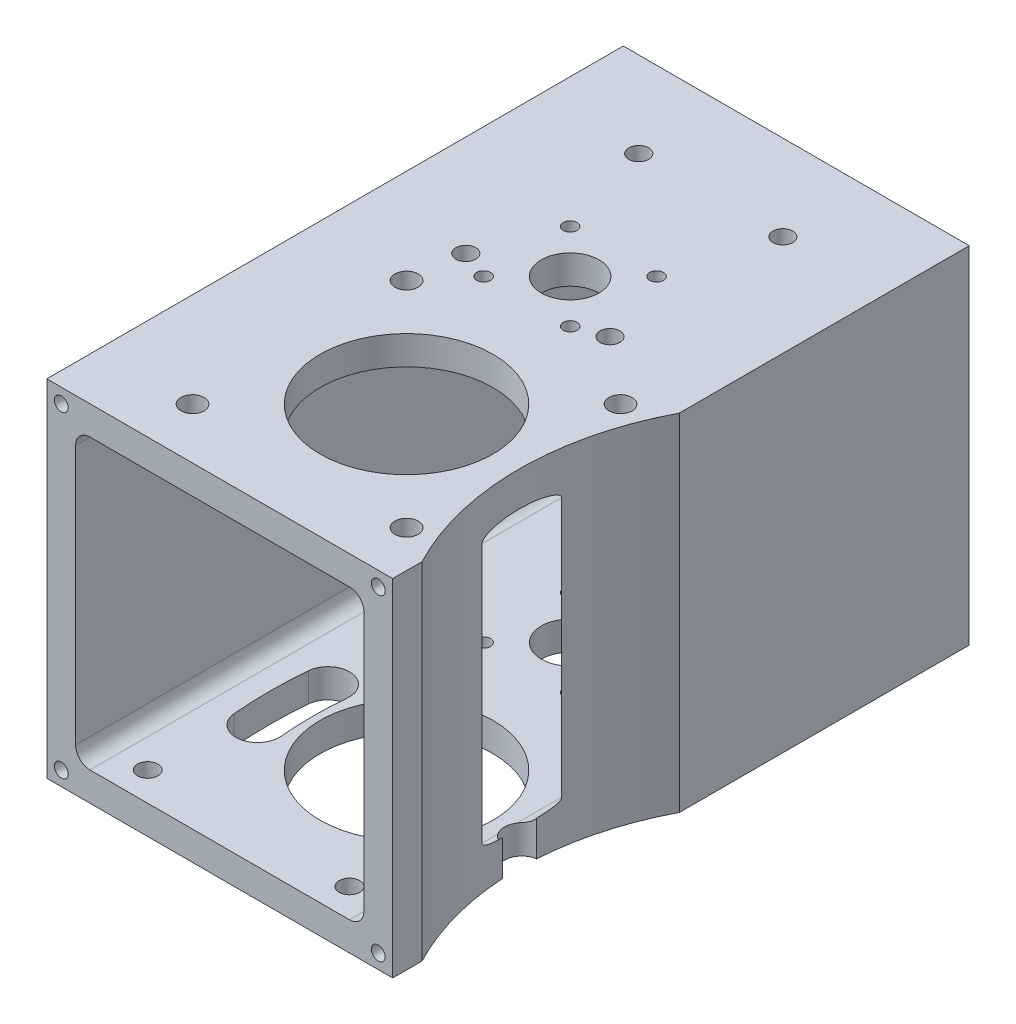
SolidWorks part; units mm, degrees
ref_plane "Front Plane" through (0, 0, 0) normal (0, 0, 1) x (1, 0, 0)
ref_plane "Top Plane" through (0, 0, 0) normal (0, 1, 0) x (1, 0, 0)
ref_plane "Right Plane" through (0, 0, 0) normal (1, 0, 0) x (0, 0, -1)
sketch "Sketch1" plane through (0, 0, 0) normal (0, 0, 1) x (1, 0, 0)
  line L1 (0, 0) -> (76.2, 0)
  line L2 (0, 0) -> (0, 76.2)
  line L3 (0, 76.2) -> (76.2, 76.2)
  line L4 (76.2, 0) -> (76.2, 76.2)
  line L5 (9.525, 69.85) -> (66.675, 69.85)
  line L6 (6.35, 66.675) -> (6.35, 9.525)
  line L7 (9.525, 6.35) -> (66.675, 6.35)
  line L8 (69.85, 66.675) -> (69.85, 9.525)
  arc A0 (9.525, 69.85) -> (6.35, 66.675) centre (9.525, 66.675) ccw
  arc A1 (66.675, 69.85) -> (69.85, 66.675) centre (66.675, 66.675) cw
  arc A2 (66.675, 6.35) -> (69.85, 9.525) centre (66.675, 9.525) ccw
  arc A3 (6.35, 9.525) -> (9.525, 6.35) centre (9.525, 9.525) ccw
  dimension "D7" = 3.175
  dimension "D1" = 76.2
  dimension "D2" = 76.2
  dimension "D3" = 6.35
  dimension "D4" = 6.35
  dimension "D5" = 6.35
  dimension "D6" = 6.35
extrude "Extrude1" add sketch "Sketch1" against normal blind 127
ref_plane "Plane1" through (44.45, 0, 0) normal (1, 0, 0) x (0, 0, -1)
sketch "Sketch2" plane through (0, 0, 0) normal (0, -1, 0) x (1, 0, 0)
  circle A0 centre (44.45, -34.798) radius 19.05
  circle A1 centre (44.45, -34.798) radius 7.1438 construction
  dimension "D1" = 38.1
extrude "Cut-Extrude1" cut sketch "Sketch2" against normal up to surface (76.2 mm away)
sketch "Sketch3" plane through (0, 76.2, 0) normal (0, 1, 0) x (-1, 0, 0)
  circle A0 centre (-38.1, -77.1875) radius 6.35
  circle A1 centre (-38.1, -77.1875) radius 6.35 construction
  dimension "D1" = 12.7
extrude "Cut-Extrude2" cut sketch "Sketch3" against normal up to surface (76.2 mm away)
sketch "Sketch6" plane through (0, 76.2, 0) normal (0, 1, 0) x (-1, 0, 0)
  circle A0 centre (-130.175, -34.798) radius 60.96
  arc A1 (-149.225, -95.3731) -> (-149.225, 25.7771) centre (-130.175, -34.798) ccw construction
  dimension "D1" = 121.92
extrude "Cut-Extrude5" cut sketch "Sketch6" against normal up to surface (76.2 mm away)
sketch "Sketch7" plane through (0, 0, 0) normal (0, -1, 0) x (1, 0, 0)
  circle A0 centre (69.85, -34.798) radius 3.81
  circle A1 centre (69.85, -34.798) radius 1.524 construction
  dimension "D1" = 7.62
extrude "Cut-Extrude8" cut sketch "Sketch7" against normal blind 25.4
hole_wizard "Tap Drill for #10 Helicoil1" positions "3DSketch1" profile "Sketch8" hole size "#10-32" standard "Ansi Inch"
sketch3d "3DSketch1"
  circle A0 centre (20.8788, 76.2, -11.2268) radius 2.5527 construction
  circle A1 centre (20.8788, 76.2, -58.3692) radius 2.5527 construction
  circle A2 centre (68.0212, 76.2, -58.3692) radius 2.5527 construction
  circle A3 centre (68.0212, 76.2, -11.2268) radius 2.5527 construction
  point P0 (68.0212, 76.2, -11.2268)
  point P2 (68.0212, 76.2, -58.3692)
  point P4 (20.8788, 76.2, -11.2268)
  point P6 (20.8788, 76.2, -58.3692)
  point P11 (20.8788, 78.7527, -11.2268)
  point P14 (20.8788, 78.7527, -58.3692)
  point P17 (68.0212, 78.7527, -58.3692)
  point P20 (68.0212, 78.7527, -11.2268)
sketch "Sketch8" plane through (68.0212, 76.2, -11.2268) normal (1, 0, 0) x (0, 0, 1)
  line L0 (0, 0) -> (0, 10.6778)
  line L1 (0, 10.6778) -> (2.5527, 9.144)
  line L2 (2.5527, 9.144) -> (2.5527, 0)
  line L5 (2.5527, 0) -> (0, 0)
  line L10 (0, 10.6778) -> (-2.5527, 9.144) construction
  line L11 (0, -6.35) -> (0, 107.95) construction
  dimension "Hole Dia." = 5.1054
  dimension "Hole Depth" = 9.144
  dimension "Drill Angle" = 118
hole_wizard "#8 Clearance Hole1" positions "3DSketch2" profile "Sketch10" hole size "#8" standard "Ansi Inch"
sketch3d "3DSketch2"
  line L1 (15.875, 0, -6.35) -> (15.875, 0, -120.65) construction
  line L5 (0, 0, -127) -> (0, 0, 0) construction
  line L9 (15.875, 0, -6.35) -> (60.325, 0, -6.35) construction
  line L13 (0, 0, 0) -> (76.2, 0, 0) construction
  line L16 (60.325, 0, -6.35) -> (60.325, 0, -120.65) construction
  line L18 (15.875, 0, -120.65) -> (60.325, 0, -120.65) construction
  line L20 (76.2, 0, -127) -> (76.2, 0, -63.1321) construction
  line L21 (0, 0, -127) -> (76.2, 0, -127) construction
  point P148 (15.875, 0, -120.65)
  point P150 (15.875, 0, -6.35)
  point P203 (60.325, 0, -6.35)
  point P205 (47.625, 0, -120.65)
  dimension "D1" = 15.875
  dimension "D2" = 6.35
  dimension "D3" = 15.875
  dimension "D5" = 6.35
  dimension "D4" = 28.575
sketch "Sketch10" plane through (15.875, 0, -120.65) normal (1, 0, 0) x (0, 0, -1)
  line L0 (0, 0) -> (0, 10.4947)
  line L1 (0, 10.4947) -> (2.2479, 9.144)
  line L2 (2.2479, 9.144) -> (2.2479, 0)
  line L5 (2.2479, 0) -> (0, 0)
  line L10 (0, 10.4947) -> (-2.2479, 9.144) construction
  line L11 (0, -6.35) -> (0, 107.95) construction
  dimension "Hole Dia." = 4.4958
  dimension "Hole Depth" = 9.144
  dimension "Drill Angle" = 118
hole_wizard "Tap Drill for #4 Helicoil1" positions "3DSketch3" profile "Sketch11" hole size "#4-40" standard "Ansi Inch"
sketch3d "3DSketch3"
  line L1 (3.175, 73.025, 0) -> (73.025, 73.025, 0) construction
  line L2 (3.175, 73.025, 0) -> (3.175, 3.175, 0) construction
  line L3 (3.175, 3.175, 0) -> (73.025, 3.175, 0) construction
  line L4 (73.025, 73.025, 0) -> (73.025, 3.175, 0) construction
  line L5 (0, 76.2, 0) -> (0, 0, 0) construction
  line L6 (76.2, 0, 0) -> (76.2, 76.2, 0) construction
  line L7 (76.2, 76.2, 0) -> (0, 76.2, 0) construction
  line L8 (0, 0, 0) -> (76.2, 0, 0) construction
  point P0 (3.175, 73.025, 0)
  point P2 (73.025, 73.025, 0)
  point P4 (73.025, 3.175, 0)
  point P6 (3.175, 3.175, 0)
  dimension "D1" = 3.175
  dimension "D2" = 3.175
  dimension "D3" = 3.175
  dimension "D4" = 3.175
sketch "Sketch11" plane through (3.175, 73.025, 0) normal (1, 0, 0) x (0, -1, 0)
  line L0 (0, 0) -> (0, 10.0597)
  line L1 (0, 10.0597) -> (1.524, 9.144)
  line L2 (1.524, 9.144) -> (1.524, 0)
  line L5 (1.524, 0) -> (0, 0)
  line L10 (0, 10.0597) -> (-1.524, 9.144) construction
  line L11 (0, -6.35) -> (0, 107.95) construction
  dimension "Hole Dia." = 3.048
  dimension "Hole Depth" = 9.144
  dimension "Drill Angle" = 118
hole_wizard "Tap Drill for #4 Helicoil2" positions "3DSketch4" profile "Sketch12" hole size "#4-40" standard "Ansi Inch"
sketch3d "3DSketch4"
  circle A0 centre (3.175, 73.025, 0) radius 1.524 construction
  circle A1 centre (73.025, 73.025, 0) radius 1.524 construction
  circle A2 centre (73.025, 3.175, 0) radius 1.524 construction
  circle A3 centre (3.175, 3.175, 0) radius 1.524 construction
  point P0 (73.025, 73.025, -127)
  point P2 (3.175, 73.025, -127)
  point P4 (3.175, 3.175, -127)
  point P6 (73.025, 3.175, -127)
  point P175 (3.175, 73.025, 1.524)
  point P178 (73.025, 73.025, 1.524)
  point P181 (73.025, 3.175, 1.524)
  point P184 (3.175, 3.175, 1.524)
sketch "Sketch12" plane through (73.025, 73.025, -127) normal (1, 0, 0) x (0, 1, 0)
  line L0 (0, 0) -> (0, 10.0597)
  line L1 (0, 10.0597) -> (1.524, 9.144)
  line L2 (1.524, 9.144) -> (1.524, 0)
  line L5 (1.524, 0) -> (0, 0)
  line L10 (0, 10.0597) -> (-1.524, 9.144) construction
  line L11 (0, -6.35) -> (0, 107.95) construction
  dimension "Hole Dia." = 3.048
  dimension "Hole Depth" = 9.144
  dimension "Drill Angle" = 118
hole_wizard "Tap Drill for #8 Helicoil1" positions "3DSketch5" profile "Sketch13" hole size "#8-32" standard "Ansi Inch"
sketch3d "3DSketch5"
  circle A0 centre (22.225, 76.2, -108.1755) radius 2.2479 construction
  circle A1 centre (53.975, 76.2, -108.1755) radius 2.2479 construction
  circle A2 centre (22.225, 76.2, -70.0755) radius 2.2479 construction
  circle A3 centre (53.975, 76.2, -70.0755) radius 2.2479 construction
  point P0 (22.225, 76.2, -108.1755)
  point P2 (53.975, 76.2, -70.0755)
  point P4 (53.975, 76.2, -108.1755)
  point P6 (22.225, 76.2, -70.0755)
  point P12 (22.225, 73.9521, -108.1755)
  point P15 (53.975, 73.9521, -108.1755)
  point P18 (22.225, 73.9521, -70.0755)
  point P21 (53.975, 73.9521, -70.0755)
sketch "Sketch13" plane through (22.225, 76.2, -108.1755) normal (1, 0, 0) x (0, 0, 1)
  line L0 (0, 0) -> (0, 10.4642)
  line L1 (0, 10.4642) -> (2.1971, 9.144)
  line L2 (2.1971, 9.144) -> (2.1971, 0)
  line L5 (2.1971, 0) -> (0, 0)
  line L10 (0, 10.4642) -> (-2.1971, 9.144) construction
  line L11 (0, -6.35) -> (0, 107.95) construction
  dimension "Hole Dia." = 4.3942
  dimension "Hole Depth" = 9.144
  dimension "Drill Angle" = 118
sketch "Sketch16" plane through (0, 0, 0) normal (0, -1, 0) x (1, 0, 0)
  line L0 (107.95, -34.798) -> (19.3883, -27.0499) construction
  line L1 (107.95, -34.798) -> (19.3883, -42.5461) construction
  line L2 (107.95, -34.798) -> (56.9591, -107.6206) construction
  line L3 (107.95, -34.798) -> (70.3792, -115.3688) construction
  line L4 (14.6439, -26.6348) -> (24.1327, -27.4649) construction
  line L5 (14.6439, -42.9612) -> (24.1327, -42.1311) construction
  line L6 (68.3665, -119.6851) -> (72.392, -111.0525) construction
  line L7 (54.2274, -111.5218) -> (59.6907, -103.7194) construction
  circle A0 centre (107.95, -34.798) radius 88.9 construction
  arc A4 (107.95, -136.398) -> (107.95, 66.802) centre (107.95, -34.798) ccw construction
  arc A5 (16.858, -42.7675) -> (21.9186, -42.3248) centre (19.3883, -42.5461) ccw construction
  arc A6 (21.9186, -27.2712) -> (16.858, -26.8285) centre (19.3883, -27.0499) ccw construction
  arc A7 (69.3058, -117.6708) -> (71.4527, -113.0667) centre (70.3792, -115.3688) ccw construction
  arc A8 (58.4159, -105.54) -> (55.5022, -109.7013) centre (56.9591, -107.6206) ccw construction
  arc A9 (14.6439, -42.9612) -> (14.6439, -26.6348) centre (107.95, -34.798) cw
  arc A10 (24.1327, -42.1311) -> (24.1327, -27.4649) centre (107.95, -34.798) cw
  arc A11 (68.3665, -119.6851) -> (54.2274, -111.5218) centre (107.95, -34.798) cw
  arc A12 (72.392, -111.0525) -> (59.6907, -103.7194) centre (107.95, -34.798) cw
  arc A13 (24.1327, -27.4649) -> (14.6439, -26.6348) centre (19.3883, -27.0499) ccw
  arc A14 (14.6439, -42.9612) -> (24.1327, -42.1311) centre (19.3883, -42.5461) ccw
  arc A15 (59.6907, -103.7194) -> (54.2274, -111.5218) centre (56.9591, -107.6206) ccw
  arc A16 (68.3665, -119.6851) -> (72.392, -111.0525) centre (70.3792, -115.3688) ccw
  point P2 (19.3883, -42.5461)
  point P3 (19.3883, -27.0499)
  point P8 (56.9591, -107.6206)
  point P10 (70.3792, -115.3688)
  dimension "D1" = 9.525
  dimension "D2" = 9.525
extrude "Cut-Extrude9" cut sketch "Sketch16" against normal blind 25.4 contours A11 A16 A12 A15 | A9 A14 A10 A13
hole_wizard "Tap Drill for #4 Helicoil3" positions "3DSketch6" profile "Sketch17" hole size "#4-40" standard "Ansi Inch"
sketch3d "3DSketch6"
  circle A0 centre (28.575, 6.35, -86.7125) radius 1.6319 construction
  circle A1 centre (47.625, 6.35, -86.7125) radius 1.632 construction
  circle A2 centre (47.625, 6.35, -67.6625) radius 1.632 construction
  circle A3 centre (28.575, 6.35, -67.6625) radius 1.632 construction
  point P0 (28.575, 6.35, -67.6625)
  point P2 (47.625, 6.35, -67.6625)
  point P4 (28.575, 6.35, -86.7125)
  point P6 (47.625, 6.35, -86.7125)
  point P11 (28.575, 4.7181, -86.7125)
  point P14 (47.625, 4.718, -86.7125)
  point P17 (47.625, 4.7181, -67.6625)
  point P20 (28.575, 4.7181, -67.6625)
sketch "Sketch17" plane through (28.575, 6.35, -67.6625) normal (1, 0, 0) x (0, 0, 1)
  line L0 (0, 0) -> (0, 10.0597)
  line L1 (0, 10.0597) -> (1.524, 9.144)
  line L2 (1.524, 9.144) -> (1.524, 0)
  line L5 (1.524, 0) -> (0, 0)
  line L10 (0, 10.0597) -> (-1.524, 9.144) construction
  line L11 (0, -6.35) -> (0, 107.95) construction
  dimension "Hole Dia." = 3.048
  dimension "Hole Depth" = 9.144
  dimension "Drill Angle" = 118
hole_wizard "Tap Drill for #4 Helicoil4" positions "3DSketch7" profile "Sketch18" hole size "#4-40" standard "Ansi Inch"
sketch3d "3DSketch7"
  circle A0 centre (47.625, 63.5, -86.7125) radius 1.632 construction
  circle A1 centre (28.575, 63.5, -86.7125) radius 1.632 construction
  circle A2 centre (47.625, 63.5, -67.6625) radius 1.632 construction
  circle A3 centre (28.575, 63.5, -67.6625) radius 1.6319 construction
  point P0 (28.575, 69.85, -67.6625)
  point P2 (47.625, 69.85, -67.6625)
  point P4 (28.575, 69.85, -86.7125)
  point P6 (47.625, 69.85, -86.7125)
  point P11 (47.625, 61.868, -86.7125)
  point P14 (28.575, 61.868, -86.7125)
  point P17 (47.625, 61.868, -67.6625)
  point P20 (28.575, 61.868, -67.6625)
sketch "Sketch18" plane through (28.575, 69.85, -67.6625) normal (1, 0, 0) x (0, 0, -1)
  line L0 (0, 0) -> (0, 10.0597)
  line L1 (0, 10.0597) -> (1.524, 9.144)
  line L2 (1.524, 9.144) -> (1.524, 0)
  line L5 (1.524, 0) -> (0, 0)
  line L10 (0, 10.0597) -> (-1.524, 9.144) construction
  line L11 (0, -6.35) -> (0, 107.95) construction
  dimension "Hole Dia." = 3.048
  dimension "Hole Depth" = 9.144
  dimension "Drill Angle" = 118
